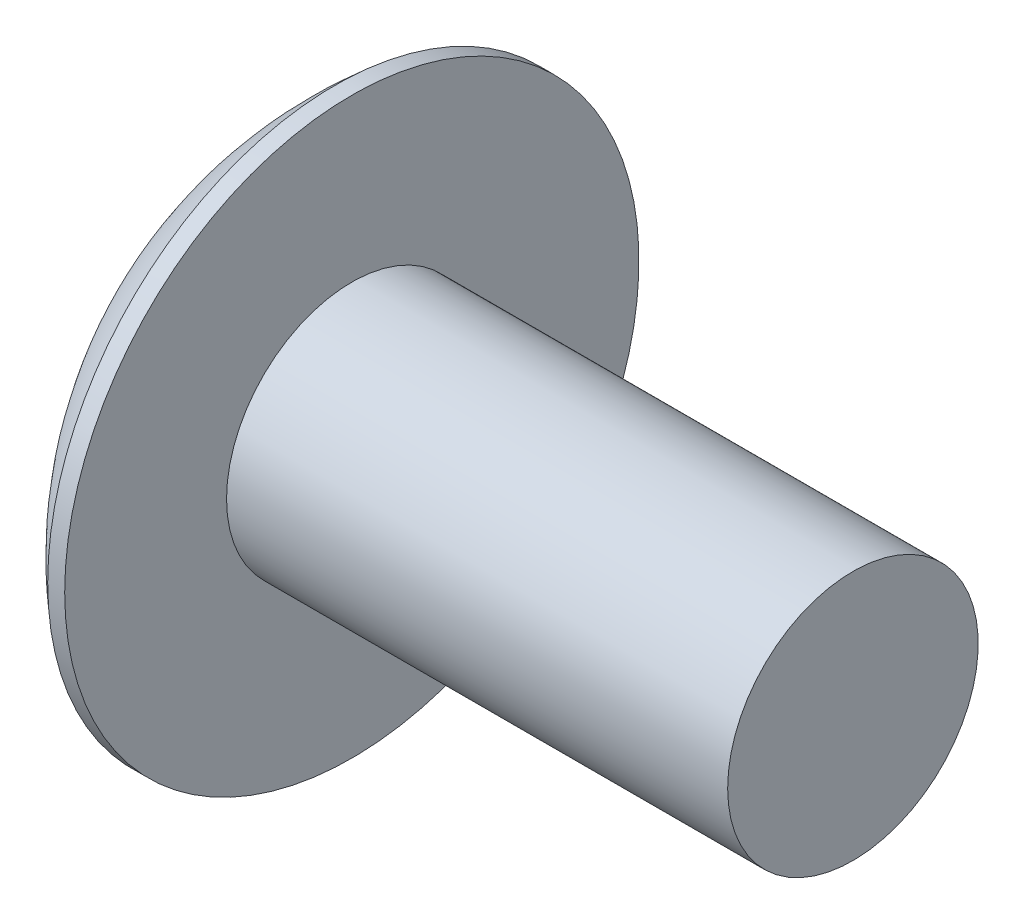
SolidWorks part; units mm, degrees
ref_plane "Plane1" through (0, 0, 0) normal (0, 0, 1) x (1, 0, 0)
ref_plane "Plane2" through (0, 0, 0) normal (0, 1, 0) x (1, 0, 0)
ref_plane "Plane3" through (0, 0, 0) normal (1, 0, 0) x (0, 0, -1)
sketch "BodySke" plane through (0, 0, 0) normal (0, 0, 1) x (1, 0, 0)
  line L0 (3.81, 3.175) -> (3.81, 7.2771)
  line L1 (16.51, 0) -> (0, 0)
  line L2 (-25.4, 0) -> (127, 0) construction
  line L3 (3.3793, -7.2771) -> (3.81, -7.2771) construction
  line L4 (3.81, 3.175) -> (16.51, 3.175)
  line L5 (16.51, 3.175) -> (16.51, 0)
  line L6 (3.3793, 7.2771) -> (3.81, 7.2771)
  line L7 (3.81, -3.175) -> (16.51, -3.175) construction
  line L8 (5.08, 4.7625) -> (5.08, -4.7625) construction
  line L9 (3.81, 6.35) -> (3.81, -3.175) construction
  arc A0 (3.3793, 7.2771) -> (0, 0) centre (9.525, 0) ccw
  dimension "Head_rad" = 9.525
  dimension "Head_ht" = 3.81
  dimension "Diameter" = 6.35
  dimension "Length" = 12.7
  dimension "Head_dia" = 14.5542
  dimension "Advance" = 1.27
  dimension "Thread_nom" = 12.7
revolve "Base-Revolve" add sketch "BodySke" angle 360 about L2
sketch "Sketch2" plane through (0, 0, 0) normal (1, 0, 0) x (0, 0, -1)
  line L0 (7.2771, -0.9525) -> (-7.2771, -0.9525)
  line L1 (7.2771, -0.9525) -> (7.2771, 0.9525)
  line L2 (-7.2771, 0.9525) -> (7.2771, 0.9525)
  line L3 (-7.2771, 0.9525) -> (-7.2771, -0.9525)
  dimension "D1" = 14.5542
  dimension "D2" = 7.2771
  dimension "Slot_width" = 1.905
  dimension "D3" = 0.9525
extrude "Slot" [suppressed] cut sketch "Sketch2" along normal blind 2.2098
sketch "Sketch3" plane through (0, 0, 0) normal (1, 0, 0) x (0, 0, -1)
  line L0 (0.7239, -4.0767) -> (-0.7239, -4.0767)
  line L1 (0.7239, -4.0767) -> (0.7239, 4.0767)
  line L2 (-0.7239, 4.0767) -> (0.7239, 4.0767)
  line L3 (-0.7239, 4.0767) -> (-0.7239, -4.0767)
  dimension "D1" = 0.7239
  dimension "Cross_width" = 1.4478
  dimension "Cross_dia" = 8.1534
  dimension "D2" = 4.0767
ref_plane "Plane4" through (4.6228, 0, 0) normal (1, 0, 0) x (0, 0, -1)
sketch "Sketch4" plane through (4.6228, 0, 0) normal (1, 0, 0) x (0, 0, -1)
  line L0 (0.3619, -0.3619) -> (-0.3619, -0.362)
  line L1 (0.3619, -0.3619) -> (0.3619, 0.3619)
  line L2 (-0.3619, 0.3619) -> (0.3619, 0.3619)
  line L3 (-0.3619, 0.3619) -> (-0.3619, -0.362)
  dimension "D1" = 0.7239
  dimension "D2" = 0.3619
  dimension "D3" = 0.7239
  dimension "D4" = 0.3619
loft "Cross" cut profiles "Sketch3", "Sketch4"
pattern_circular "CirPattern1" count 2 every 90 about axis through (0, 0, 0) along (1, 0, 0) of "Cross"
sketch "ThdSchSke" plane through (0, 0, 0) normal (0, 0, 1) x (1, 0, 0)
  line L0 (5.08, -2.4193) -> (4.5509, -3.175)
  line L1 (5.08, -2.4193) -> (5.6091, -3.175)
  line L2 (5.6091, -3.175) -> (5.6091, -3.9688)
  line L3 (-3.175, 0) -> (5.1513, 0) construction
  line L5 (5.6091, -3.9688) -> (4.5509, -3.9688)
  line L6 (4.5509, -3.9688) -> (4.5509, -3.175)
  dimension "Thread_minor" = 4.8387
  dimension "Diameter" = 6.35
  dimension "Start" = 5.08
  dimension "SideAngle" = 55
  dimension "VeeAngle" = 70
  dimension "Overcut" = 7.9375
revolve "ThreadSchematic" [suppressed] cut sketch "ThdSchSke" angle 360 about L3
pattern_linear "ThdSchPat" [suppressed]
equation "\"D1@Sketch2\" = \"Head_dia@BodySke\""
equation "\"D2@Sketch2\" = \"D1@Sketch2\" / 2"
equation "\"D3@Sketch2\" = \"Slot_width@Sketch2\" / 2"
equation "\"D1@Sketch3\" = \"Cross_width@Sketch3\" / 2"
equation "\"D2@Sketch3\" = \"Cross_dia@Sketch3\" / 2"
equation "\"D1@Sketch4\" = \"Cross_width@Sketch3\" *.5"
equation "\"D2@Sketch4\" = \"D1@Sketch4\" / 2"
equation "\"D3@Sketch4\" = \"D1@Sketch4\""
equation "\"D4@Sketch4\" = \"D3@Sketch4\" / 2"
equation "\"Thread_length@ThreadCosmetic\" = ((sgn( (\"Length@BodySke\" - \"Advance@BodySke\" ) - \"Thread_nom@BodySke\" )-1)*( (\"Length@BodySke\" - \"Advance@BodySke\" ) - \"Thread_nom@BodySke\" ))/-2+ \"Thread_nom@BodySke\""
equation "\"Thread_minor@ThdSchSke\" = \"Thread_minor@ThreadCosmetic\""
equation "\"Diameter@ThdSchSke\" = \"Diameter@BodySke\""
equation "\"Overcut@ThdSchSke\" = \"Diameter@BodySke\" * 1.25"
equation "\"Start@ThdSchSke\" = \"Head_ht@BodySke\" + \"Length@BodySke\" - \"Thread_length@ThreadCosmetic\"  '---Non-countersunk---"
equation "\"Num_threads@ThdSchPat\" = int( \"Thread_length@ThreadCosmetic\" / \"Advance@BodySke\" + 0.999 )  + 1"
equation "\"Advance@ThdSchPat\" = \"Thread_length@ThreadCosmetic\" /  (\"Num_threads@ThdSchPat\" - 1) 'relax it"
